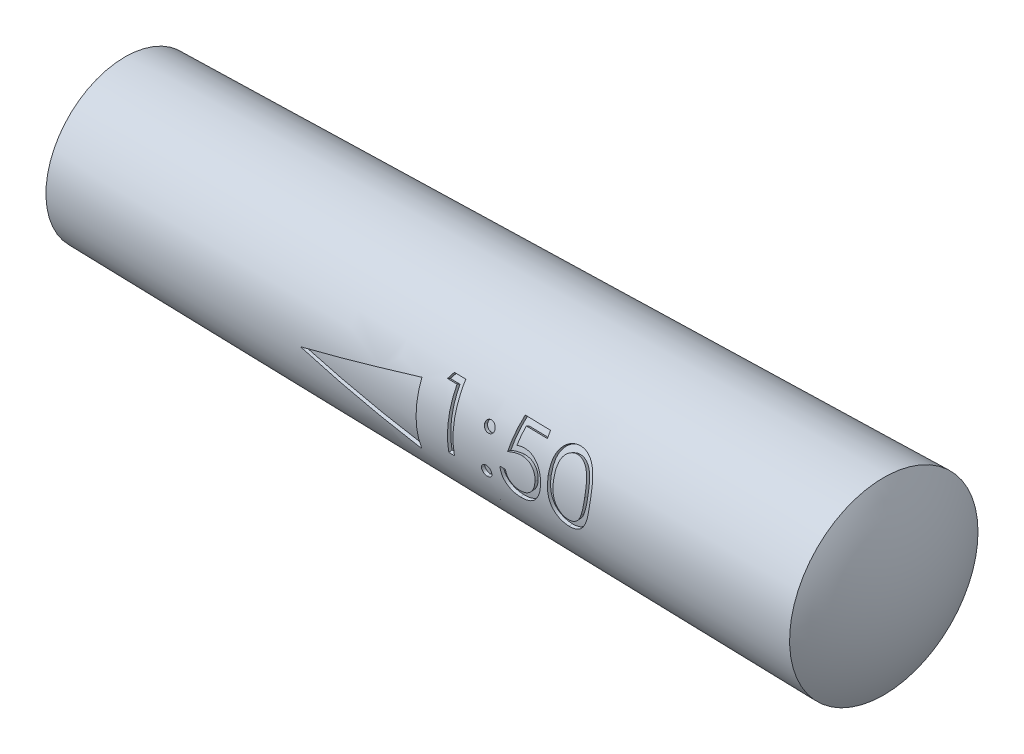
SolidWorks part; units mm, degrees
ref_plane "Front Plane" through (0, 0, 0) normal (0, 0, 1) x (1, 0, 0)
ref_plane "Top Plane" through (0, 0, 0) normal (0, 1, 0) x (1, 0, 0)
ref_plane "Right Plane" through (0, 0, 0) normal (1, 0, 0) x (0, 0, -1)
sketch "Sketch1" plane through (0, 0, 0) normal (1, 0, 0) x (0, 0, -1)
  circle A0 centre (0, 0) radius 1.25
  dimension "D1" = 2.5
extrude "Extrude1" add sketch "Sketch1" along normal mid plane 12
draft "Draft1" type of draft neutral plane draft angle 1.146 faces to draft 1 parameters "D1"=1.146
sketch "Sketch2" plane through (0, 0, 0) normal (0, 0, 1) x (1, 0, 0)
  line L0 (-6, 0) -> (-6, 1.25)
  line L1 (-6, 1.25) -> (-6, -1.25) construction
  line L2 (-6, 0) -> (-6.4, 0)
  line L3 (-6.4, 0) -> (-6.4, -1.37) construction
  line L4 (6, 0) -> (6, 1.49)
  line L5 (6, -1.49) -> (6, 1.49) construction
  line L6 (6, 0) -> (6.4, 0)
  line L7 (6.4, 0) -> (6.4, -1.37) construction
  line L8 (-6, -1.25) -> (6, -1.49) construction
  arc A0 (-6.4, 0) -> (-6, 1.25) centre (-4.2469, 0) cw
  arc A1 (6.4, 0) -> (6, 1.49) centre (3.4248, 0) ccw
  point P14 (0, -1.37)
revolve "Revolve1" add sketch "Sketch2" angle 360 about L2
sketch "Sketch5" plane through (0, 0, 0) normal (0, 0, 1) x (1, 0, 0)
  line L0 (0, 1.37) -> (0, -1.37) construction
  line L1 (6, 1.49) -> (-6, 1.25) construction
  line L2 (-6, -1.25) -> (6, -1.49) construction
ref_plane "Plane2" through (0, 0, 0) normal (-0.02, 0, 0.9998) x (0.9998, 0, 0.02)
sketch "Sketch6" plane through (0, 0, 0) normal (-0.02, 0, 0.9998) x (0.9998, 0, 0.02)
  line L0 (0, 0) -> (0, 0.5)
  line L1 (0, 1.37) -> (0, -1.37) construction
  line L2 (0, 0.5) -> (-1.866, 0)
  line L3 (-1.866, 0) -> (0, -0.5)
  line L4 (0, -0.5) -> (0, 0)
  line L5 (0, -0.25) -> (3, -0.25) construction
  text T0 "1:50" font "Century Gothic" height 1
  dimension "D1" = 1
  dimension "D2" = 30
  dimension "D3" = 3
wrap "Wrap2" sketch "Sketch6" wrap type deboss source sketch "Sketch6" thickness 0.05 parameters "D1"=0.05
equation "\"D2@Sketch2\" = \"D1@Sketch2\""
